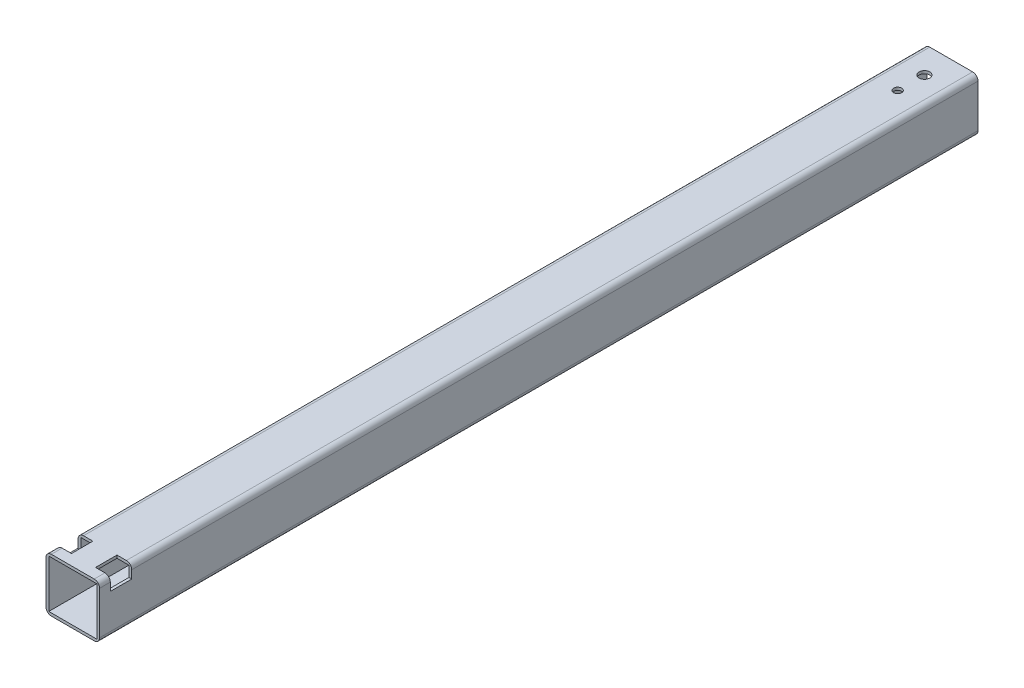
SolidWorks part; units mm, degrees
ref_plane "Front Plane" through (0, 0, 0) normal (0, 0, 1) x (1, 0, 0)
ref_plane "Top Plane" through (0, 0, 0) normal (0, 1, 0) x (1, 0, 0)
ref_plane "Right Plane" through (0, 0, 0) normal (1, 0, 0) x (0, 0, -1)
sketch "Sketch1" plane through (0, 0, 0) normal (0, 0, 1) x (1, 0, 0)
  line L1 (15.875, 15.875) -> (-15.875, 15.875)
  line L2 (15.875, 15.875) -> (15.875, -15.875)
  line L3 (15.875, -15.875) -> (-15.875, -15.875)
  line L4 (-15.875, 15.875) -> (-15.875, -15.875)
  line L5 (15.875, 15.875) -> (-15.875, -15.875) construction
  line L6 (15.875, -15.875) -> (-15.875, 15.875) construction
  point P0 (0, 0)
  dimension "D1" = 31.75
  dimension "D2" = 31.75
extrude "Extrude-Thin1" add sketch "Sketch1" along normal blind 520.7 thin
fillet "Fillet1" radius 3.175 4 edges at (15.875, -15.875, 260.35) (-15.875, -15.875, 260.35) (-15.875, 15.875, 260.35) (15.875, 15.875, 260.35)
sketch "Sketch2" plane through (0, 0, 0) normal (0, 1, 0) x (1, 0, 0)
  circle A0 centre (0, -15.875) radius 3.175
  circle A1 centre (0, -31.75) radius 2.3876
  dimension "D1" = 6.35
  dimension "D4" = 4.7752
  dimension "D2" = 15.875
  dimension "D3" = 15.875
extrude "Cut-Extrude1" cut sketch "Sketch2" against normal mid plane 50.8
sketch "Sketch4" plane through (0, 0, 0) normal (0, 1, 0) x (1, 0, 0)
  line L0 (7.1374, -514.35) -> (7.1374, -501.65)
  line L1 (7.1374, -501.65) -> (19.8374, -501.65)
  line L2 (19.8374, -501.65) -> (19.8374, -514.35)
  line L3 (19.8374, -514.35) -> (7.1374, -514.35)
  line L4 (-7.1374, -501.65) -> (-7.1374, -514.35)
  line L5 (-7.1374, -514.35) -> (-19.8374, -514.35)
  line L6 (-19.8374, -514.35) -> (-19.8374, -501.65)
  line L7 (-19.8374, -501.65) -> (-7.1374, -501.65)
  line L8 (0, 0) -> (0, -442.216) construction
  line L9 (12.7, -520.7) -> (-12.7, -520.7) construction
  dimension "D1" = 6.35
  dimension "D2" = 14.2748
  dimension "D3" = 12.7
  dimension "D4" = 12.7
extrude "Cut-Extrude2" cut sketch "Sketch4" along normal blind 25.4 from offset 7.9248
sketch "Sketch5" plane through (0, 0, 0) normal (0, 1, 0) x (1, 0, 0)
  line L0 (12.7, -520.7) -> (-12.7, -520.7) construction
  circle A0 centre (0, -495.3) radius 2.3876
  dimension "D1" = 4.7752
  dimension "D2" = 25.4
extrude "Cut-Extrude3" cut sketch "Sketch5" against normal blind 25.4
